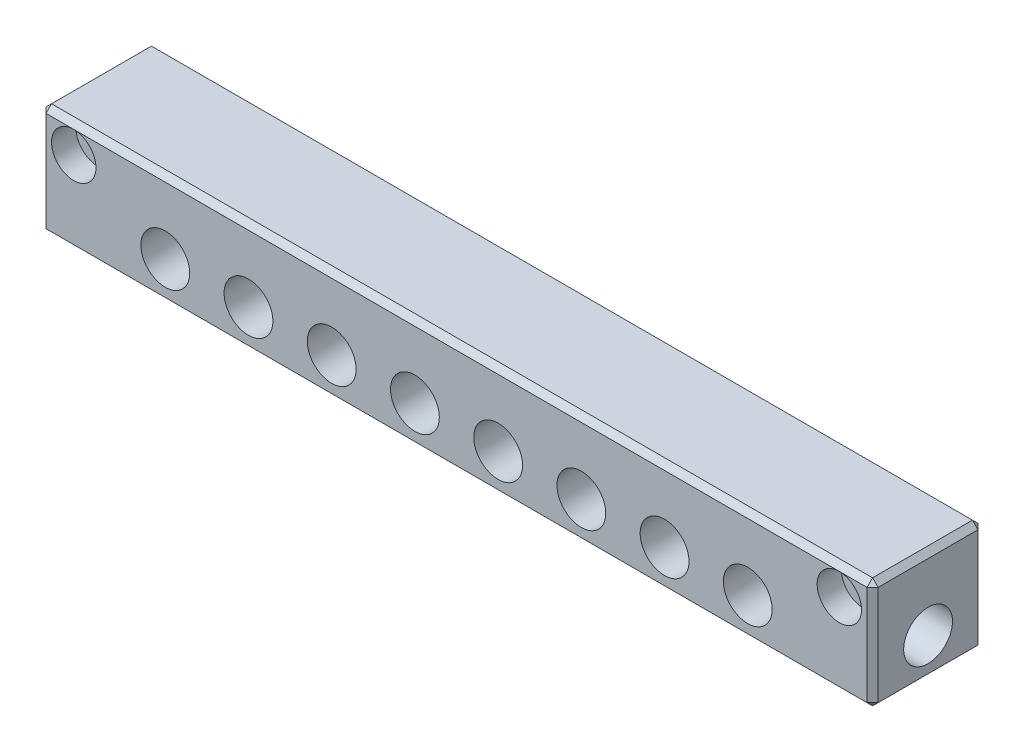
SolidWorks part; units mm, degrees
ref_plane "前视基准面" through (0, 0, 0) normal (0, 0, 1) x (1, 0, 0)
ref_plane "上视基准面" through (0, 0, 0) normal (0, 1, 0) x (1, 0, 0)
ref_plane "右视基准面" through (0, 0, 0) normal (1, 0, 0) x (0, 0, -1)
sketch "草图1" plane through (0, 0, 0) normal (0, 0, 1) x (1, 0, 0)
  line L1 (-75, 10) -> (75, 10)
  line L2 (-75, 10) -> (-75, -10)
  line L3 (-75, -10) -> (75, -10)
  line L4 (75, 10) -> (75, -10)
  line L5 (-75, 10) -> (75, -10) construction
  line L6 (-75, -10) -> (75, 10) construction
  point P0 (0, 0)
  dimension "D1" = 20
  dimension "D2" = 150
extrude "凸台-拉伸1" add sketch "草图1" along normal mid plane 20
hole_wizard "M4 六角凹头螺钉的柱形沉头孔1" positions "草图2" profile "草图3" counterbore size "M4" standard "ISO"
sketch "草图2" plane through (0, 0, 10) normal (0, 0, 1) x (1, 0, 0)
  line L0 (-75, 10) -> (-75, -10) construction
  line L1 (75, -10) -> (75, 10) construction
  line L2 (75, 10) -> (-75, 10) construction
  point P0 (-69, 5)
  point P2 (69, 5)
  dimension "D1" = 6
  dimension "D2" = 6
  dimension "D3" = 5
  dimension "D4" = 5
sketch "草图3" plane through (-69, 5, 10) normal (1, 0, 0) x (0, -1, 0)
  line L0 (0, 0) -> (0, 20)
  line L1 (0, 20) -> (2.25, 20)
  line L3 (2.25, 20) -> (2.25, 4.4)
  line L4 (2.25, 4.4) -> (4, 4.4)
  line L5 (4, 4.4) -> (4, 0)
  line L7 (4, 0) -> (0, 0)
  line L11 (0, -6.35) -> (0, 107.95) construction
  dimension "通孔孔直径" = 4.5
  dimension "通孔孔深度" = 20
  dimension "柱形沉头孔直径" = 8
  dimension "柱形沉头孔深度" = 4.4
hole_wizard "G1/8 螺纹孔1" positions "草图4" profile "草图5" tap size "G1/8" standard "ISO"
sketch "草图4" plane through (0, 0, 10) normal (0, 0, 1) x (1, 0, 0)
  line L0 (-75, -10) -> (75, -10) construction
  circle A2 centre (-69, 5) radius 4 construction
  point P0 (-52.5, -3)
  point P13 (-37.5, -3)
  point P14 (-22.5, -3)
  point P15 (-7.5, -3)
  point P16 (7.5, -3)
  point P17 (22.5, -3)
  point P18 (37.5, -3)
  point P19 (52.5, -3)
  dimension "D1" = 16.5
  dimension "D2" = 7
  dimension "D4" = 15
  dimension "D3" = 8
sketch "草图5" plane through (-52.5, -3, 10) normal (1, 0, 0) x (0, -1, 0)
  line L0 (0, 0) -> (0, 18.6438)
  line L1 (0, 18.6438) -> (4.4, 16)
  line L2 (4.4, 16) -> (4.4, 0)
  line L5 (4.4, 0) -> (0, 0)
  line L10 (0, 18.6438) -> (-4.4, 16) construction
  line L11 (0, -6.35) -> (0, 107.95) construction
  dimension "螺纹孔钻头直径" = 8.8
  dimension "螺纹孔钻头深度" = 16
  dimension "导头角度" = 118
hole_wizard "G1/8 螺纹孔2" positions "草图6" profile "草图7" tap size "G1/8" standard "ISO"
sketch "草图6" plane through (75, 0, 0) normal (1, 0, 0) x (0, 0, -1)
  line L0 (-10, -10) -> (10, -10) construction
  line L1 (-10, -10) -> (-10, 10) construction
  point P0 (0, -3)
  dimension "D1" = 7
  dimension "D2" = 10
sketch "草图7" plane through (75, -3, 0) normal (0, 1, 0) x (0, 0, -1)
  line L0 (0, 0) -> (0, 132.6438)
  line L1 (0, 132.6438) -> (4.4, 130)
  line L2 (4.4, 130) -> (4.4, 0)
  line L5 (4.4, 0) -> (0, 0)
  line L10 (0, 132.6438) -> (-4.4, 130) construction
  line L11 (0, -6.35) -> (0, 107.95) construction
  dimension "螺纹孔钻头直径" = 8.8
  dimension "螺纹孔钻头深度" = 130
  dimension "导头角度" = 118
chamfer "倒角1" distance 1 12 edges at (75, 10, 0) (0, 10, 10) (-75, 10, 0) (0, 10, -10) (-75, -10, 0) (-75, 0, 10) (0, -10, 10) (75, 0, 10) (75, -10, 0) (-75, 0, -10) (0, -10, -10) (75, 0, -10)
